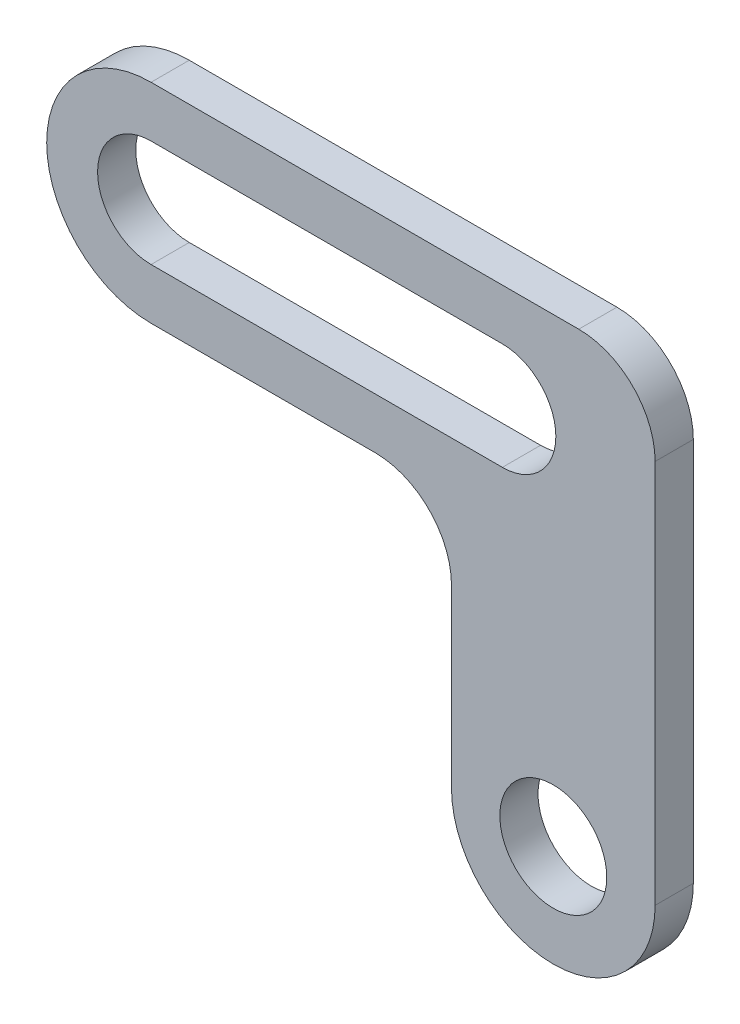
SolidWorks part; units mm, degrees
ref_plane "Plan de face" through (0, 0, 0) normal (0, 0, 1) x (1, 0, 0)
ref_plane "Plan de dessus" through (0, 0, 0) normal (0, 1, 0) x (1, 0, 0)
ref_plane "Plan de droite" through (0, 0, 0) normal (1, 0, 0) x (0, 0, -1)
sketch "Esquisse1" plane through (0, 0, 0) normal (0, 0, 1) x (1, 0, 0)
  line L1 (40, 0) -> (40, 181)
  line L2 (40, 181) -> (-158, 181)
  line L4 (-158, 99) -> (-40, 99)
  line L5 (-40, 99) -> (-40, 0)
  line L7 (-158, 161) -> (-20, 161)
  line L9 (-158, 119) -> (-20, 119)
  circle A0 centre (0, 0) radius 21
  arc A1 (-20, 119) -> (-20, 161) centre (-20, 140) ccw
  arc A2 (-158, 161) -> (-158, 119) centre (-158, 140) ccw
  arc A3 (-158, 181) -> (-158, 99) centre (-158, 140) ccw
  arc A4 (-40, 0) -> (40, 0) centre (0, 0) ccw
  dimension "D4" = 42
  dimension "D1" = 42
  dimension "D2" = 20
  dimension "D3" = 140
  dimension "D5" = 20
  dimension "D7" = 138
  dimension "D8" = 60
extrude "Boss.-Extru.1" add sketch "Esquisse1" along normal blind 15
fillet "Congé1" radius 30 2 edges at (-40, 99, 7.5) (40, 181, 7.5)
